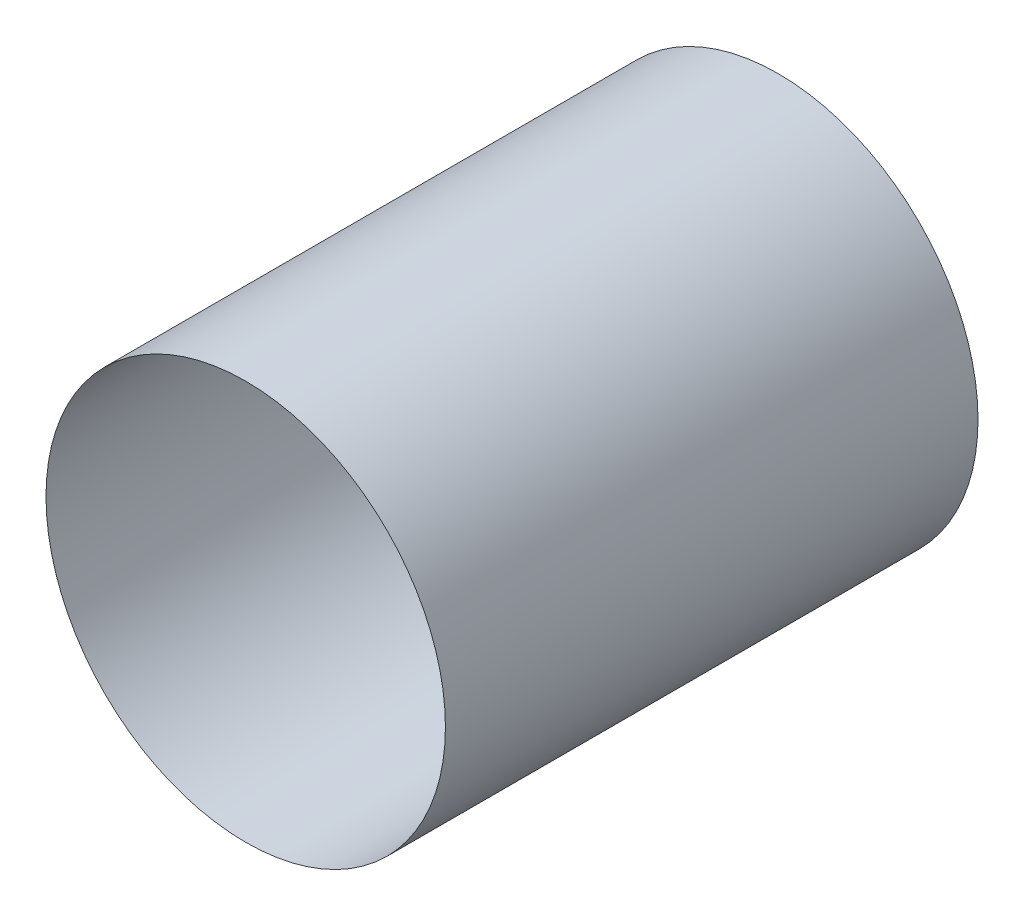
SolidWorks part; units mm, degrees
ref_plane "Ebene vorne" through (0, 0, 0) normal (0, 0, 1) x (1, 0, 0)
ref_plane "Ebene oben" through (0, 0, 0) normal (0, 1, 0) x (1, 0, 0)
ref_plane "Ebene rechts" through (0, 0, 0) normal (1, 0, 0) x (0, 0, -1)
sketch "Skizze1" plane through (0, 0, 0) normal (0, 0, 1) x (1, 0, 0)
  circle A0 centre (0, 0) radius 7.5
  dimension "D1" = 15
surface "Oberfläche-Linear austragen1" sketch "Skizze1" parameters "D1"=20
equation "\"LÄNGE\"=0"
equation "\"BREITE\"=0"
equation "\"HÖHE\"=0"
equation "\"DURCHMESSER\"=0"
equation "\"Stückzahl\"= 1"
